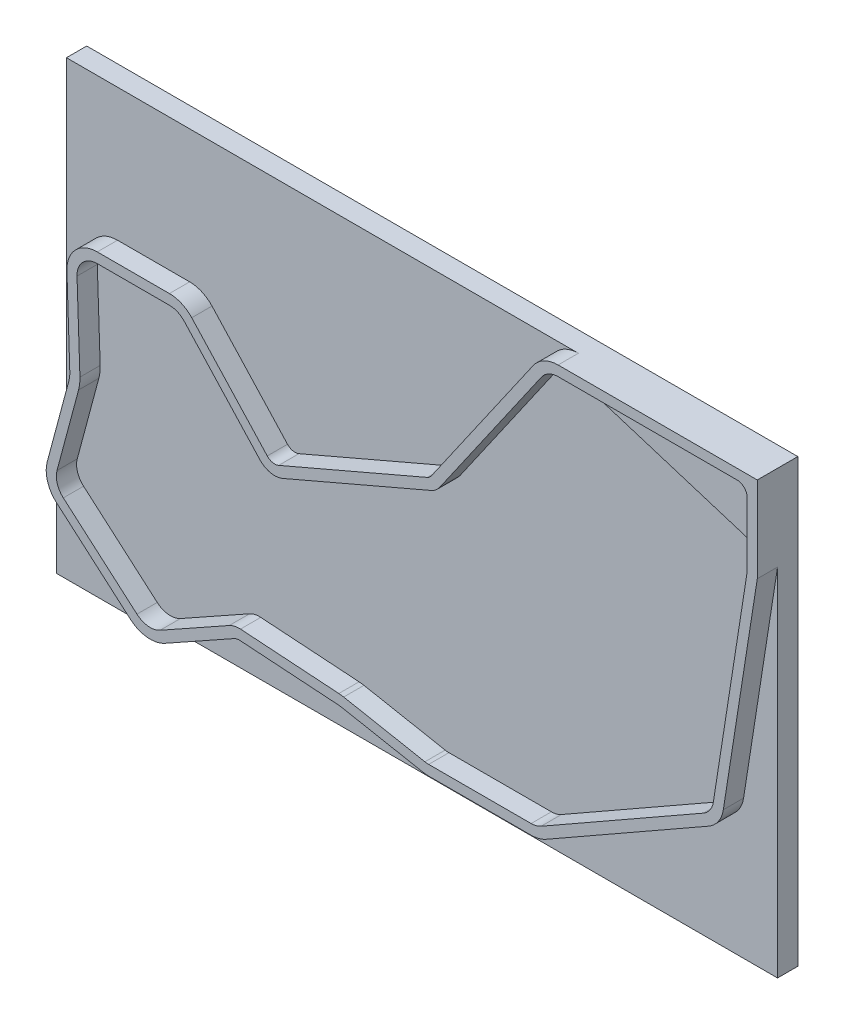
SolidWorks part; units mm, degrees
ref_plane "Front Plane" through (0, 0, 0) normal (0, 0, 1) x (1, 0, 0)
ref_plane "Top Plane" through (0, 0, 0) normal (0, 1, 0) x (1, 0, 0)
ref_plane "Right Plane" through (0, 0, 0) normal (1, 0, 0) x (0, 0, -1)
sketch "Sketch1" plane through (0, 0, 0) normal (0, 0, 1) x (1, 0, 0)
  line L1 (-1.8635, -35.4859) -> (-58.4971, -67.1758)
  line L2 (20.2704, 69.7869) -> (-35.7681, 130.5797)
  line L36 (324.3764, 213.6373) -> (189.5656, 213.6373)
  line L37 (324.3764, 213.6373) -> (324.3764, 160.0141)
  line L59 (324.3764, 160.0141) -> (301.6786, 14.8971)
  line L60 (301.6786, 14.8971) -> (187.6536, -50.0951)
  line L61 (187.6536, -50.0951) -> (116.6048, -50.0951)
  line L62 (116.6048, -50.0951) -> (62.8062, -39.8478)
  line L63 (62.8062, -39.8478) -> (-1.8635, -35.4859)
  line L65 (-123.7804, -10.5869) -> (-58.4971, -67.1758)
  line L66 (189.5656, 213.6373) -> (119.0632, 112.25)
  line L67 (119.0632, 112.25) -> (20.2704, 69.7869)
  line L69 (-35.7681, 130.5797) -> (-109.0221, 130.5797)
  line L70 (-109.0221, 130.5797) -> (-106.4536, 54.1223)
  line L71 (-106.4536, 54.1223) -> (-123.7804, -10.5869)
extrude "Extrude1" add sketch "Sketch1" against normal blind 12.7
fillet "Fillet1" radius 19.05 10 edges at (189.5656, 213.6373, -6.35) (-35.7681, 130.5797, -6.35) (-109.0221, 130.5797, -6.35) (-123.7804, -10.5869, -6.35) (-106.4536, 54.1223, -6.35) (-58.4971, -67.1758, -6.35) (62.8062, -39.8478, -6.35) (116.6048, -50.0951, -6.35) (187.6536, -50.0951, -6.35) (301.6786, 14.8971, -6.35)
fillet "Fillet2" radius 6.35 3 edges at (-1.8635, -35.4859, -6.35) (119.0632, 112.25, -6.35) (20.2704, 69.7869, -6.35)
sketch "Sketch2" plane through (0, 0, 0) normal (0, 0, 1) x (1, 0, 0)
  line L30 (318.0264, 207.2873) -> (199.5217, 207.2873)
  line L31 (189.0949, 201.8379) -> (125.3136, 110.116)
  line L32 (119.9019, 105.6987) -> (26.9078, 65.728)
  line L33 (12.5547, 68.7882) -> (-34.7787, 120.1374)
  line L34 (-44.1167, 124.2297) -> (-89.3214, 124.2297)
  line L35 (-102.0142, 111.1033) -> (-100.2023, 57.1664)
  line L36 (-101.0523, 49.7438) -> (-114.5633, -0.7149)
  line L37 (-110.6139, -13.5963) -> (-64.4451, -53.6164)
  line L38 (-49.9251, -55.1028) -> (-6.6104, -30.8655)
  line L39 (0.4458, -29.2772) -> (62.0834, -33.4346)
  line L40 (65.1267, -33.8256) -> (116.0266, -43.5208)
  line L41 (118.4029, -43.7451) -> (182.6057, -43.7451)
  line L42 (188.8946, -42.0787) -> (290.564, 15.8711)
  line L43 (296.8225, 24.9421) -> (318.0264, 160.5077)
  line L44 (318.0264, 160.5077) -> (318.0264, 207.2873)
  line L45 (318.0264, 207.2873) -> (199.5217, 207.2873)
  line L46 (189.0949, 201.8379) -> (125.3136, 110.116)
  line L47 (119.9019, 105.6987) -> (26.9078, 65.728)
  line L48 (12.5547, 68.7882) -> (-34.7787, 120.1374)
  line L49 (-44.1167, 124.2297) -> (-89.3214, 124.2297)
  line L50 (-102.0142, 111.1033) -> (-100.2023, 57.1664)
  line L51 (-101.0523, 49.7438) -> (-114.5633, -0.7149)
  line L52 (-110.6139, -13.5963) -> (-64.4451, -53.6164)
  line L53 (-49.9251, -55.1028) -> (-6.6104, -30.8655)
  line L54 (0.4458, -29.2772) -> (62.0834, -33.4346)
  line L55 (65.1267, -33.8256) -> (116.0266, -43.5208)
  line L56 (118.4029, -43.7451) -> (182.6057, -43.7451)
  line L57 (188.8946, -42.0787) -> (290.564, 15.8711)
  line L58 (296.8225, 24.9421) -> (318.0264, 160.5077)
  line L59 (318.0264, 160.5077) -> (318.0264, 207.2873)
  arc A28 (199.5217, 207.2873) -> (189.0949, 201.8379) centre (199.5217, 194.5873) ccw
  arc A29 (119.9019, 105.6987) -> (125.3136, 110.116) centre (114.8868, 117.3666) ccw
  arc A30 (12.5547, 68.7882) -> (26.9078, 65.728) centre (21.8927, 77.3959) ccw
  arc A31 (-34.7787, 120.1374) -> (-44.1167, 124.2297) centre (-44.1167, 111.5297) ccw
  arc A32 (-89.3214, 124.2297) -> (-102.0142, 111.1033) centre (-89.3214, 111.5297) ccw
  arc A33 (-101.0523, 49.7438) -> (-100.2023, 57.1664) centre (-125.588, 56.3136) ccw
  arc A34 (-114.5633, -0.7149) -> (-110.6139, -13.5963) centre (-102.2955, -3.9997) ccw
  arc A35 (-64.4451, -53.6164) -> (-49.9251, -55.1028) centre (-56.1266, -44.0199) ccw
  arc A36 (0.4458, -29.2772) -> (-6.6104, -30.8655) centre (-0.4088, -41.9484) ccw
  arc A37 (65.1267, -33.8256) -> (62.0834, -33.4346) centre (60.3741, -58.777) ccw
  arc A38 (116.0266, -43.5208) -> (118.4029, -43.7451) centre (118.4029, -31.0451) ccw
  arc A39 (182.6057, -43.7451) -> (188.8946, -42.0787) centre (182.6057, -31.0451) ccw
  arc A40 (290.564, 15.8711) -> (296.8225, 24.9421) centre (284.2751, 26.9046) ccw
  arc A42 (199.5217, 207.2873) -> (189.0949, 201.8379) centre (199.5217, 194.5873) ccw
  arc A43 (119.9019, 105.6987) -> (125.3136, 110.116) centre (114.8868, 117.3666) ccw
  arc A44 (12.5547, 68.7882) -> (26.9078, 65.728) centre (21.8927, 77.3959) ccw
  arc A45 (-34.7787, 120.1374) -> (-44.1167, 124.2297) centre (-44.1167, 111.5297) ccw
  arc A46 (-89.3214, 124.2297) -> (-102.0142, 111.1033) centre (-89.3214, 111.5297) ccw
  arc A47 (-101.0523, 49.7438) -> (-100.2023, 57.1664) centre (-125.588, 56.3136) ccw
  arc A48 (-114.5633, -0.7149) -> (-110.6139, -13.5963) centre (-102.2955, -3.9997) ccw
  arc A49 (-64.4451, -53.6164) -> (-49.9251, -55.1028) centre (-56.1266, -44.0199) ccw
  arc A50 (0.4458, -29.2772) -> (-6.6104, -30.8655) centre (-0.4088, -41.9484) ccw
  arc A51 (65.1267, -33.8256) -> (62.0834, -33.4346) centre (60.3741, -58.777) ccw
  arc A52 (116.0266, -43.5208) -> (118.4029, -43.7451) centre (118.4029, -31.0451) ccw
  arc A53 (182.6057, -43.7451) -> (188.8946, -42.0787) centre (182.6057, -31.0451) ccw
  arc A54 (290.564, 15.8711) -> (296.8225, 24.9421) centre (284.2751, 26.9046) ccw
  dimension "D1" = 6.35
extrude "Extrude2" cut sketch "Sketch2" against normal through all
sketch "Sketch3" plane through (0, 0, -12.7) normal (0, 0, -1) x (-1, 0, 0)
  line L1 (-324.3764, 213.6373) -> (121.3455, 213.6373)
  line L2 (-324.3764, 213.6373) -> (-324.3764, -63.0699)
  line L3 (-324.3764, -63.0699) -> (121.3455, -63.0699)
  line L4 (121.3455, 213.6373) -> (121.3455, -63.0699)
  arc A0 (114.7732, -18.3945) -> (120.6972, 0.9276) centre (102.2955, -3.9997) ccw construction
  arc A1 (46.8243, -60.6442) -> (68.6043, -58.4146) centre (56.1266, -44.0199) ccw construction
extrude "Extrude3" add sketch "Sketch3" along normal blind 12.7
sketch "Sketch4" plane through (0, 0, -12.7) normal (0, 0, 1) x (1, 0, 0)
  line L6 (-68.6043, -58.4146) -> (-114.7732, -18.3945)
  line L7 (-121.3455, -3.9997) -> (-121.3455, -63.0699)
  line L8 (-121.3455, -63.0699) -> (-56.1266, -63.0699)
  line L9 (-68.6043, -58.4146) -> (-114.7732, -18.3945)
  line L10 (-121.3455, -3.9997) -> (-121.3455, -63.0699)
  line L11 (-121.3455, -63.0699) -> (-56.1266, -63.0699)
  arc A4 (-68.6043, -58.4146) -> (-56.1266, -63.0699) centre (-56.1266, -44.0199) ccw
  arc A5 (-121.3455, -3.9997) -> (-114.7732, -18.3945) centre (-102.2955, -3.9997) ccw
  arc A6 (-68.6043, -58.4146) -> (-56.1266, -63.0699) centre (-56.1266, -44.0199) ccw
  arc A7 (-121.3455, -3.9997) -> (-114.7732, -18.3945) centre (-102.2955, -3.9997) ccw
  dimension "D1" = 0
extrude "Extrude4" add sketch "Sketch4" along normal blind 6.35
fillet "Fillet3" radius 12.7 1 edges at (318.0264, 160.5077, -6.35)
sketch "Sketch5" plane through (0, 0, -12.7) normal (0, 0, 1) x (1, 0, 0)
  line L0 (203.3128, 206.7083) -> (309.1174, 173.6159)
  line L1 (318.0264, 207.2873) -> (318.0264, 161.4949)
  line L2 (318.0264, 161.4949) -> (318.0264, 207.2873) construction
  line L3 (318.0264, 207.2873) -> (199.5217, 207.2873)
  line L4 (318.0264, 207.2873) -> (199.5217, 207.2873) construction
  arc A0 (318.0264, 161.4949) -> (309.1174, 173.6159) centre (305.3264, 161.4949) ccw
  arc A1 (203.3128, 206.7083) -> (199.5217, 207.2873) centre (199.5217, 194.5873) ccw
  arc A2 (317.8738, 159.5324) -> (318.0264, 161.4949) centre (305.3264, 161.4949) ccw construction
  arc A3 (199.5217, 207.2873) -> (189.0949, 201.8379) centre (199.5217, 194.5873) ccw construction
extrude "Extrude5" add sketch "Sketch5" along normal blind 6.35
fillet "Fillet4" radius 6.35 1 edges at (318.0264, 207.2873, -3.175)
